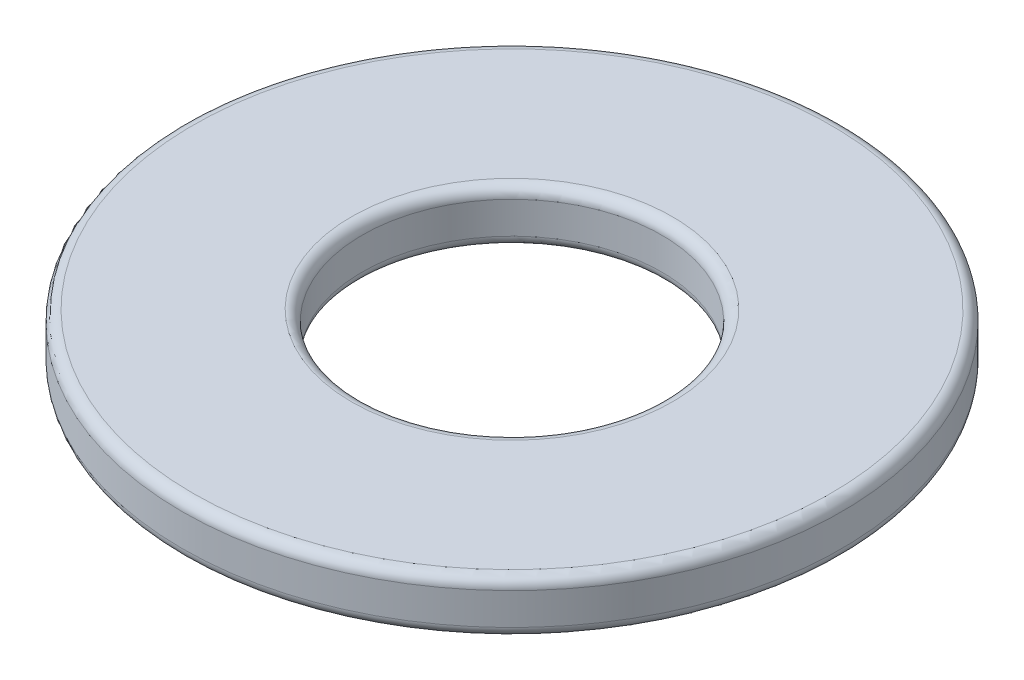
SolidWorks part; units mm, degrees
ref_plane "Front" through (0, 0, 0) normal (0, 0, 1) x (1, 0, 0)
ref_plane "Top" through (0, 0, 0) normal (0, 1, 0) x (1, 0, 0)
ref_plane "Right" through (0, 0, 0) normal (1, 0, 0) x (0, 0, -1)
sketch "Sketch1" plane through (0, 0, 0) normal (0, 1, 0) x (1, 0, 0)
  circle A0 centre (0, 0) radius 2.8575
  circle A1 centre (0, 0) radius 6.2865
  dimension "D1" = 5.715
  dimension "D2" = 12.573
extrude "Extrude1" add sketch "Sketch1" along normal blind 1.016
fillet "Fillet1" radius 0.2032 4 edges at (0, 1.016, 2.8575) (0, 1.016, 6.2865) (0, 0, 2.8575) (0, 0, 6.2865)
